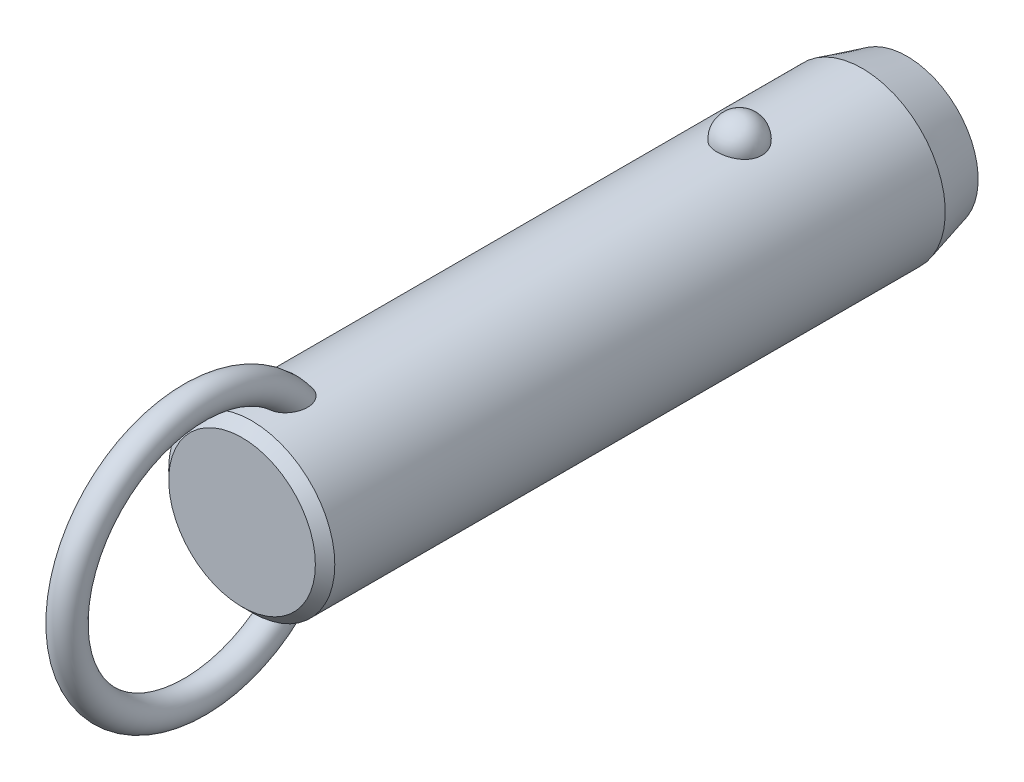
SolidWorks part; units mm, degrees
ref_plane "Front Plane" through (0, 0, 0) normal (0, 0, 1) x (1, 0, 0)
ref_plane "Top Plane" through (0, 0, 0) normal (0, 1, 0) x (1, 0, 0)
ref_plane "Right Plane" through (0, 0, 0) normal (1, 0, 0) x (0, 0, -1)
sketch "Sketch2" plane through (0, 0, 0) normal (0, 0, 1) x (1, 0, 0)
  circle A0 centre (0, 0) radius 11.1
  point P3 (0, 11.1)
  dimension "D1" = 22.2
extrude "Boss-Extrude1" add sketch "Sketch2" along normal blind 50.8
sketch "Sketch3" plane through (0, 0, 0) normal (0, 0, -1) x (-1, 0, 0)
  circle A0 centre (0, 0) radius 11.1
  dimension "D1" = 22.2
extrude "Boss-Extrude2" add sketch "Sketch3" along normal blind 25.4
chamfer "Chamfer1" distance 6 angle 15 1 edges at (-11.1, 0, -25.4)
sketch "Sketch12" plane through (0, 0, 0) normal (1, 0, 0) x (0, 0, -1)
  line L0 (-50.8, 11.1) -> (-50.8, -11.1) construction
  point P0 (-50.8, 0)
sketch "Sketch13" plane through (0, 0, 0) normal (1, 0, 0) x (0, 0, -1)
  circle A0 centre (-69.85, 0) radius 19.05
  point P2 (-50.8, 0)
  dimension "D1" = 38.1
sketch "Sketch14" plane through (0, 0, 0) normal (0, 1, 0) x (1, 0, 0)
  circle A0 centre (0, -52.8) radius 2
  point P2 (0, -50.8)
  dimension "D1" = 4
sweep "Sweep1" add profiles "Sketch14" path "Sketch13"
sketch "Sketch15" plane through (0, 0, 50.8) normal (0, 0, 1) x (1, 0, 0)
  circle A0 centre (0, 0) radius 11.1
  dimension "D1" = 22.2
extrude "Boss-Extrude3" add sketch "Sketch15" along normal blind 12.7
chamfer "Chamfer2" distance 1.3 angle 45 1 edges at (11.1, 0, 63.5)
sketch "Sketch18" plane through (0, 0, 0) normal (1, 0, 0) x (0, 0, -1)
  line L0 (19.4, 11.1) -> (-54.368, 11.1) construction
  line L1 (3, 14.1) -> (3, 8.1)
  line L2 (-54.368, -11.1) -> (19.4, -11.1) construction
  arc A0 (3, 14.1) -> (3, 8.1) centre (3, 11.1) ccw
  point P4 (0, 11.1)
  dimension "D1" = 25.2
revolve "Revolve1" add sketch "Sketch18" angle 360 about L1
